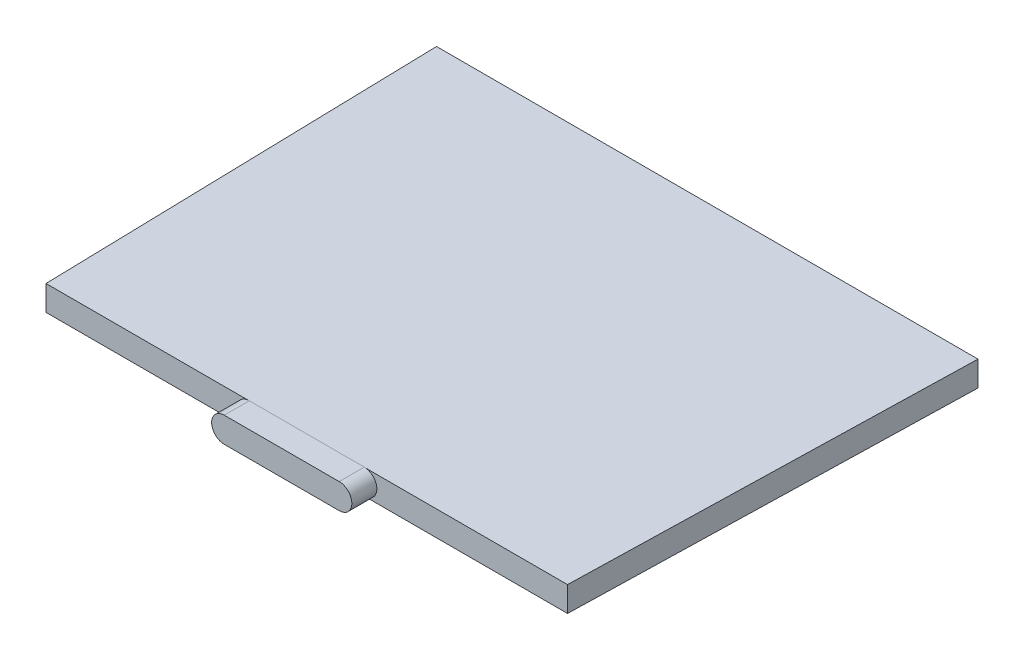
SolidWorks part; units mm, degrees
ref_plane "Front" through (0, 0, 0) normal (0, 0, 1) x (1, 0, 0)
ref_plane "Top" through (0, 0, 0) normal (0, 1, 0) x (1, 0, 0)
ref_plane "Right" through (0, 0, 0) normal (1, 0, 0) x (0, 0, -1)
sketch "Sketch1" plane through (0, 0, 0) normal (0, 1, 0) x (1, 0, 0)
  line L2 (135.195, 0) -> (-135.195, 0)
  line L5 (-130.22, -200) -> (130.22, -200)
  line L6 (-135.195, 0) -> (-130.22, -200)
  line L7 (135.195, 0) -> (130.22, -200)
  point P0 (0, 0)
  dimension "D1" = 270.39
  dimension "D2" = 260.44
  dimension "D3" = 200
extrude "Boss-Extrude1" add sketch "Sketch1" along normal blind 12.5
sketch "Sketch2" plane through (0, 0, 200) normal (0, 0, 1) x (1, 0, 0)
  line L0 (-130.22, 6.25) -> (130.22, 6.25) construction
  line L1 (-130.22, 12.5) -> (-130.22, 0) construction
  line L2 (130.22, 12.5) -> (130.22, 0) construction
  line L3 (-28.7, 6.25) -> (28.7, 6.25) construction
  line L4 (-28.7, 12.55) -> (28.7, 12.55)
  line L5 (-28.7, -0.05) -> (28.7, -0.05)
  arc A0 (-28.7, 12.55) -> (-28.7, -0.05) centre (-28.7, 6.25) ccw
  arc A1 (28.7, -0.05) -> (28.7, 12.55) centre (28.7, 6.25) ccw
  point P8 (0, 6.25)
  point P13 (-35, 6.25)
  point P14 (35, 6.25)
  dimension "D1" = 6.3
  dimension "D2" = 70
extrude "Boss-Extrude2" add sketch "Sketch2" along normal blind 12.5
